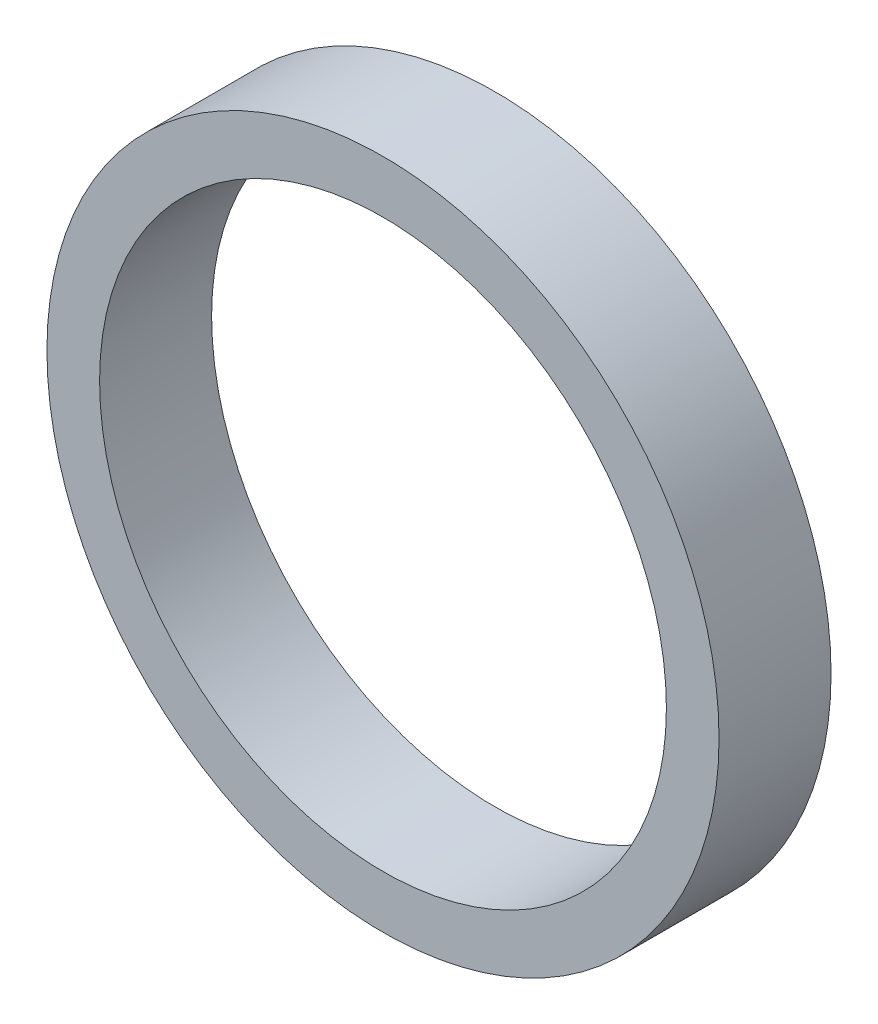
SolidWorks part; units mm, degrees
ref_plane "Front Plane" through (0, 0, 0) normal (0, 0, 1) x (1, 0, 0)
ref_plane "Top Plane" through (0, 0, 0) normal (0, 1, 0) x (1, 0, 0)
ref_plane "Right Plane" through (0, 0, 0) normal (1, 0, 0) x (0, 0, -1)
sketch "Sketch1" plane through (0, 0, 0) normal (0, 0, 1) x (1, 0, 0)
  circle A0 centre (0, 0) radius 16.0655
  circle A1 centre (0, 0) radius 19.05
  dimension "D1" = 32.131
  dimension "D2" = 38.1
extrude "Extrude1" add sketch "Sketch1" along normal blind 6.35
